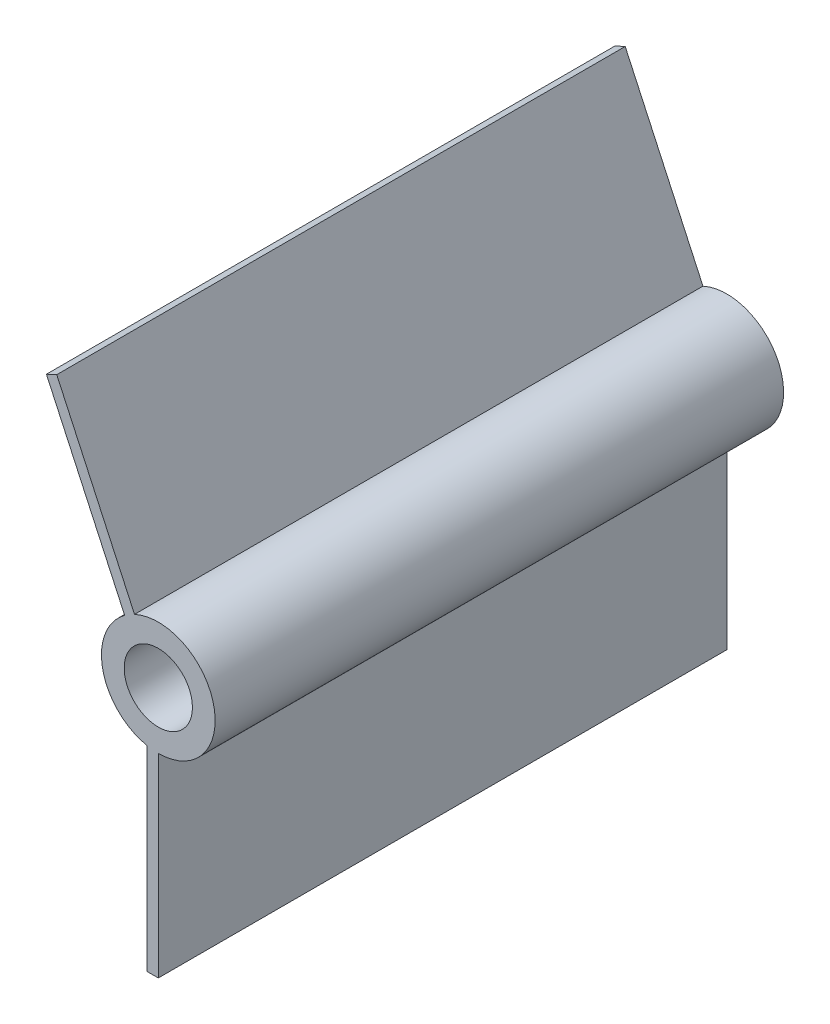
SolidWorks part; units mm, degrees
ref_plane "前视基准面" through (0, 0, 0) normal (0, 0, 1) x (1, 0, 0)
ref_plane "上视基准面" through (0, 0, 0) normal (0, 1, 0) x (1, 0, 0)
ref_plane "右视基准面" through (0, 0, 0) normal (1, 0, 0) x (0, 0, -1)
sketch "草图1" plane through (0, 0, 0) normal (0, 0, 1) x (1, 0, 0)
  line L0 (-17.8656, 38.7575) -> (0, 0)
  line L1 (0, 0) -> (0, -44.2246)
extrude "拉伸-薄壁1" add sketch "草图1" along normal mid plane 100 thin
sketch "草图2" plane through (0, 0, 0) normal (0, 0, 1) x (1, 0, 0)
  circle A0 centre (0, 0) radius 10
  dimension "D1" = 20
extrude "凸台-拉伸1" add sketch "草图2" along normal mid plane 100
sketch "草图3" plane through (0, 0, 50) normal (0, 0, 1) x (1, 0, 0)
  circle A0 centre (0, 0) radius 6
  dimension "D1" = 12
extrude "切除-拉伸1" cut sketch "草图3" against normal through all both and the other way through all
